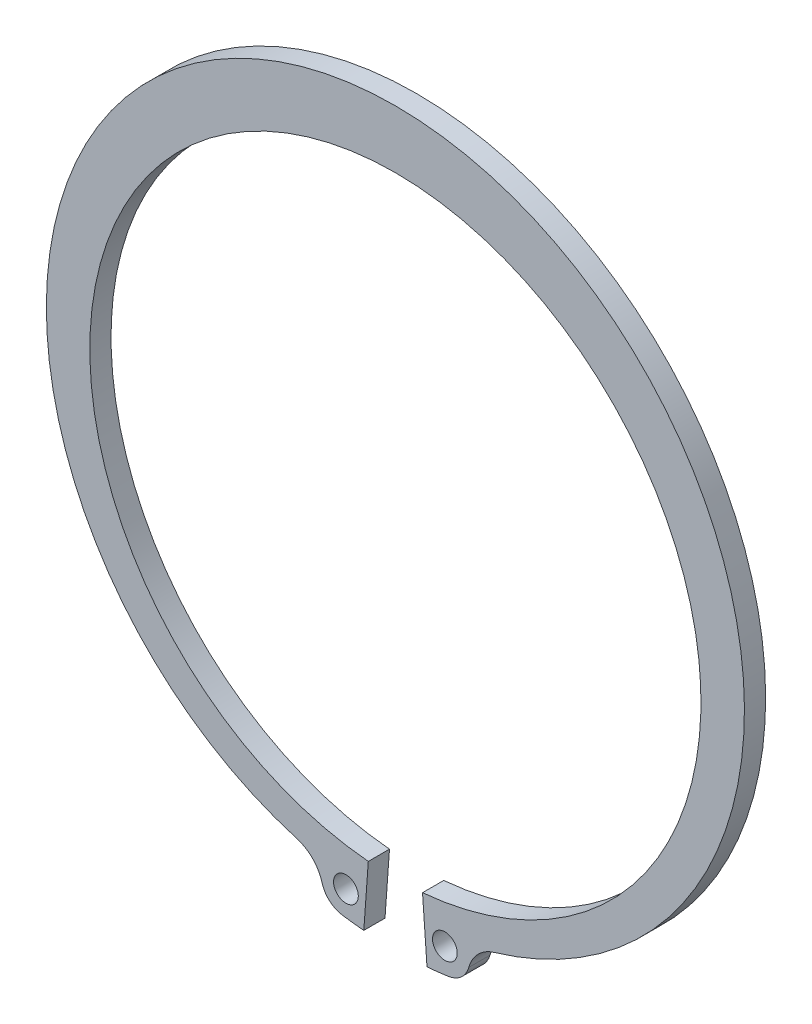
SolidWorks part; units mm, degrees
ref_plane "Face" through (0, 0, 0) normal (0, 0, 1) x (1, 0, 0)
ref_plane "Dessus" through (0, 0, 0) normal (0, 1, 0) x (1, 0, 0)
ref_plane "Droite" through (0, 0, 0) normal (1, 0, 0) x (0, 0, -1)
sketch "Esquisse1" plane through (0, 0, 0) normal (0, 0, 1) x (1, 0, 0)
  line L0 (0, 51.45) -> (0, 43.25) construction
  line L1 (3.8366, -43.0795) -> (4.4719, -51.8565)
  line L2 (-3.8366, -43.0795) -> (-4.4719, -51.8565)
  line L3 (0.7, -42.2442) -> (0.7, -51.0442) construction
  line L4 (-0.7, -42.2442) -> (-0.7, -51.0442) construction
  arc A0 (3.8366, -43.0795) -> (-3.8366, -43.0795) centre (0, 0) ccw
  arc A1 (13.9533, -45.3385) -> (-13.9533, -45.3385) centre (0, 2.05) ccw
  arc A2 (4.4719, -51.8565) -> (7.5079, -51.5047) centre (0, 0) ccw
  circle A3 centre (7.003, -48.0413) radius 1.75
  arc A4 (7.5079, -51.5047) -> (10.3763, -48.9746) centre (7.003, -48.0413) ccw
  arc A5 (13.9533, -45.3385) -> (10.3763, -48.9746) centre (15.4362, -50.3747) ccw
  circle A6 centre (-7.003, -48.0413) radius 1.75
  arc A7 (-13.9533, -45.3385) -> (-10.3763, -48.9746) centre (-15.4362, -50.3747) cw
  arc A8 (-7.5079, -51.5047) -> (-10.3763, -48.9746) centre (-7.003, -48.0413) cw
  arc A9 (-4.4719, -51.8565) -> (-7.5079, -51.5047) centre (0, 0) cw
  arc A10 (0.7, -42.2442) -> (-0.7, -42.2442) centre (0, 0) ccw construction
  circle A11 centre (0, 0) radius 45 construction
  dimension "dgorge" = 86.5
  dimension "D3" = 2.05
  dimension "dtrou" = 3.5
  dimension "D8" = 3.5
  dimension "D9" = 5.25
  dimension "dint" = 84.5
  dimension "dn" = 90
  dimension "b" = 8.2
  dimension "a" = 8.8
  dimension "D5" = 10.178
  dimension "D7" = 2.8
  dimension "D12" = 1.4
  dimension "D13" = 1.899
  dimension "D14" = 4.14
extrude "Base-Extrusion" add sketch "Esquisse1" along normal blind 3
equation "\"D3@Esquisse1\" = \"b@Esquisse1\"/4"
equation "\"D7@Esquisse1\"=\"dtrou@Esquisse1\"*0.8"
equation "\"D8@Esquisse1\" = \"dtrou@Esquisse1\""
equation "\"D9@Esquisse1\" = \"dtrou@Esquisse1\"*1.5"
equation "\"D12@Esquisse1\" = \"dtrou@Esquisse1\"*0.4"
equation "\"D5@Esquisse1\" = 360-(360-\"D13@Esquisse1\")*\"dint@Esquisse1\"/\"dgorge@Esquisse1\""
equation "\"D14@Esquisse1\" = (\"D5@Esquisse1\"-\"D13@Esquisse1\")/2"
